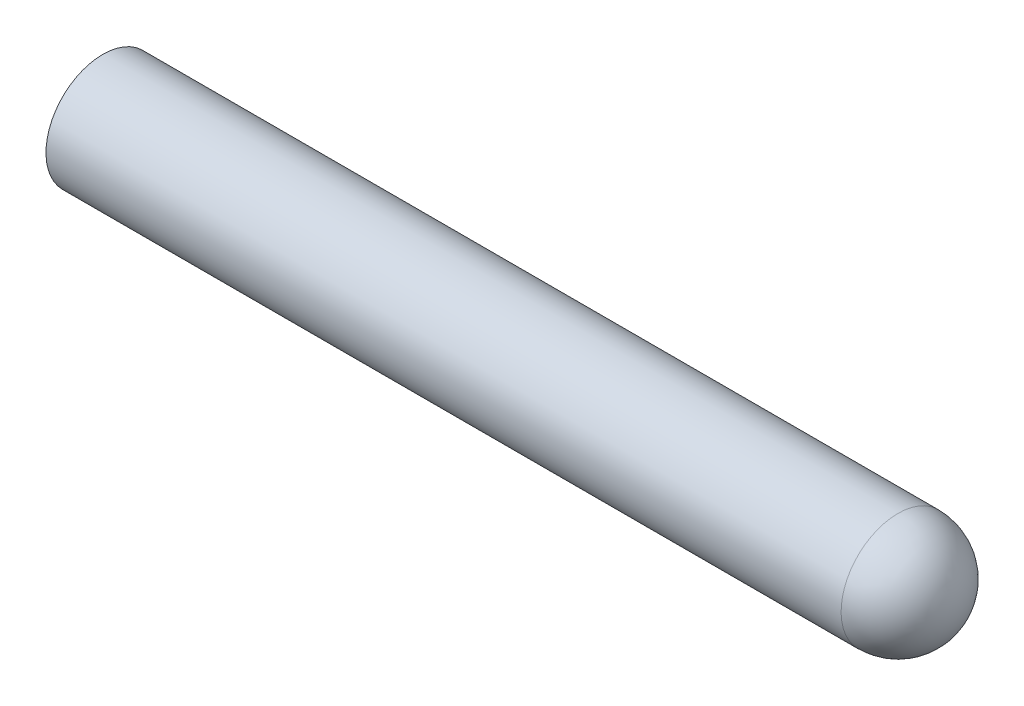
SolidWorks part; units mm, degrees
ref_plane "Front Plane" through (0, 0, 0) normal (0, 0, 1) x (1, 0, 0)
ref_plane "Top Plane" through (0, 0, 0) normal (0, 1, 0) x (1, 0, 0)
ref_plane "Right Plane" through (0, 0, 0) normal (1, 0, 0) x (0, 0, -1)
sketch "Sketch1" plane through (0, 0, 0) normal (0, 0, 1) x (1, 0, 0)
  line L0 (0, 0) -> (140, 0)
  line L1 (150, -10) -> (0, -10)
  line L2 (0, -10) -> (0, 0)
  arc A0 (140, 0) -> (150, -10) centre (140, -10) cw
  dimension "D1" = 150
  dimension "D2" = 10
revolve "Revolve1" add sketch "Sketch1" angle 360 about L1
